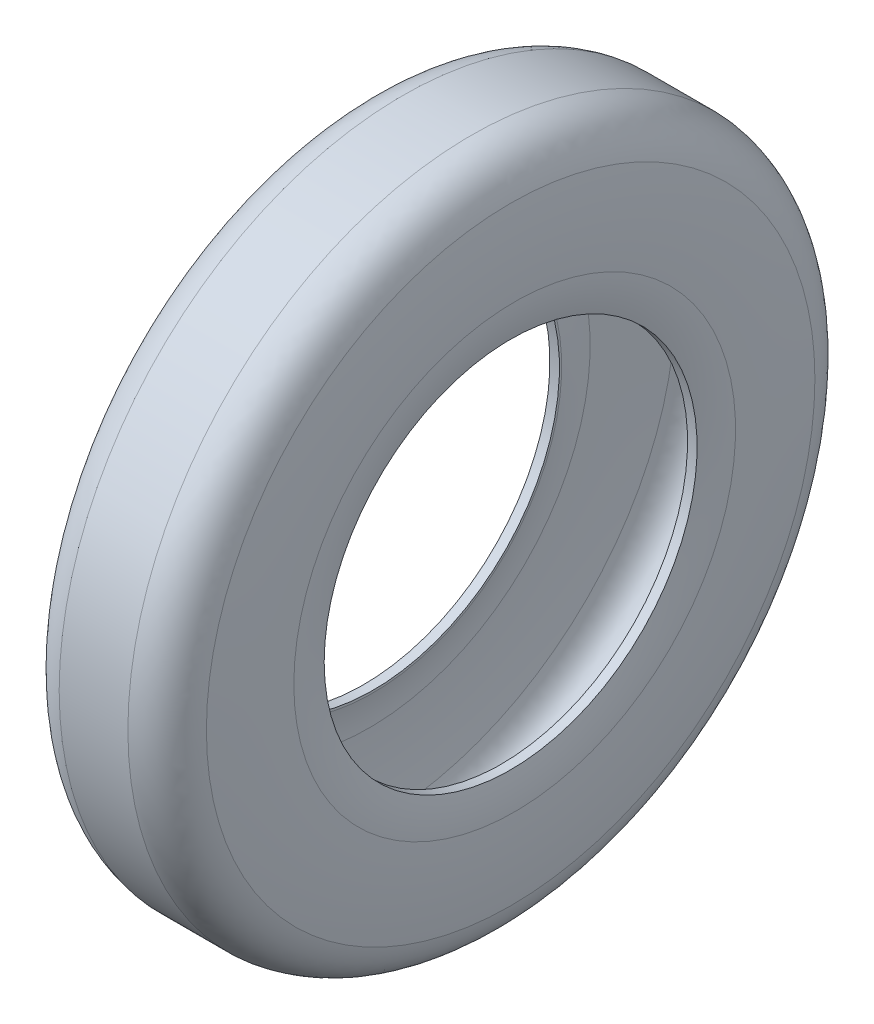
SolidWorks part; units mm, degrees
ref_plane "Ön Düzlem" through (0, 0, 0) normal (0, 0, 1) x (1, 0, 0)
ref_plane "Üst Düzlem" through (0, 0, 0) normal (0, 1, 0) x (1, 0, 0)
ref_plane "Sağ Düzlem" through (0, 0, 0) normal (1, 0, 0) x (0, 0, -1)
sketch "Çizim2" plane through (0, 0, 0) normal (0, 0, 1) x (1, 0, 0)
  line L0 (0, 112.5154) -> (0, -123.6776) construction
  line L1 (-171.6939, 0) -> (207.6774, 0) construction
  line L3 (-17.5, 175) -> (17.5, 175)
  line L4 (-17.1241, 170) -> (17.1241, 170)
  line L5 (-68.69, 112.5154) -> (0, 112.5154) construction
  line L6 (-89.2627, 155) -> (0, 155) construction
  line L7 (0, 198.2876) -> (0, 112.5154) construction
  line L8 (-37.5, 95) -> (-32.6358, 95)
  line L9 (36.6186, 112.5154) -> (37.5, 112.5154) construction
  line L10 (-32.6358, 95) -> (-32.6358, 96.1573)
  line L11 (37.5, 95) -> (32.6358, 95)
  line L12 (32.6358, 95) -> (32.6358, 96.1573)
  spline S0 degree 2 poles (-37.5, 95) (-39.5538, 103.6325) (-39.558, 112.5154) knots 0 0 0 1 1 1
  spline S1 degree 2 poles (37.5, 95) (39.5538, 103.6325) (39.558, 112.5154) knots 0 0 0 1 1 1
  spline S2 degree 2 poles (-39.558, 112.5154) (-40.0375, 133.8236) (-37.5, 155) knots 0 0 0 1 1 1
  spline S3 degree 2 poles (-37.5, 155) (-33.1808, 172.7357) (-17.5, 175) knots 0 0 0 1 1 1
  spline S4 degree 2 poles (39.558, 112.5154) (40.0375, 133.8236) (37.5, 155) knots 0 0 0 1 1 1
  spline S5 degree 2 poles (37.5, 155) (33.1808, 172.7357) (17.5, 175) knots 0 0 0 1 1 1
  spline S6 degree 1 poles (-32.6358, 96.1573) (-34.558, 112.5728) knots 0 0 1 1 construction
  spline S7 degree 1 poles (-34.558, 112.5728) (-32.5719, 154.1003) knots 0 0 1 1 construction
  spline S8 degree 1 poles (-32.5719, 154.1003) (-17.1241, 170) knots 0 0 1 1 construction
  spline S9 degree 1 poles (32.5719, 154.1003) (17.1241, 170) knots 0 0 1 1 construction
  spline S10 degree 1 poles (34.558, 112.5728) (32.5719, 154.1003) knots 0 0 1 1 construction
  spline S11 degree 1 poles (32.6358, 96.1573) (34.558, 112.5728) knots 0 0 1 1 construction
  spline S12 degree 2 poles (-32.6358, 96.1573) (-34.5602, 104.2428) (-34.558, 112.5728) knots 0 0 0 1.0031 1.0031 1.0031
  spline S13 degree 2 poles (-34.558, 112.5728) (-35.0306, 133.4011) (-32.5719, 154.1003) knots -0.001292 -0.001292 -0.001292 0.992681 0.992681 0.992681
  spline S14 degree 2 poles (-32.5719, 154.1003) (-31.8471, 156.9629) (-29.8374, 161.5064) (-26.9425, 165.4997) (-23.3007, 168.1045) (-19.4743, 169.6202) (-17.1241, 170) knots 0.009024 0.009024 0.009024 0.192379 0.375735 0.620209 0.803564 0.986919 0.986919 0.986919
  spline S15 degree 2 poles (17.1241, 170) (19.4743, 169.6202) (23.3007, 168.1045) (26.9425, 165.4997) (29.8374, 161.5064) (31.8471, 156.9629) (32.5719, 154.1003) knots 0.009024 0.009024 0.009024 0.192379 0.375735 0.620209 0.803564 0.986919 0.986919 0.986919
  spline S16 degree 2 poles (32.5719, 154.1003) (35.0306, 133.4011) (34.558, 112.5728) knots -0.001292 -0.001292 -0.001292 0.992681 0.992681 0.992681
  spline S17 degree 2 poles (34.558, 112.5728) (34.5602, 104.2428) (32.6358, 96.1573) knots 0 0 0 1.0031 1.0031 1.0031
  point P12 (37.5, 175)
  point P15 (-37.5, 175)
  dimension "D1" = 75
  dimension "D2" = 5
  dimension "D3" = 95
  dimension "D4" = 175
revolve "Döndür2" add sketch "Çizim2" angle 360 about L1
